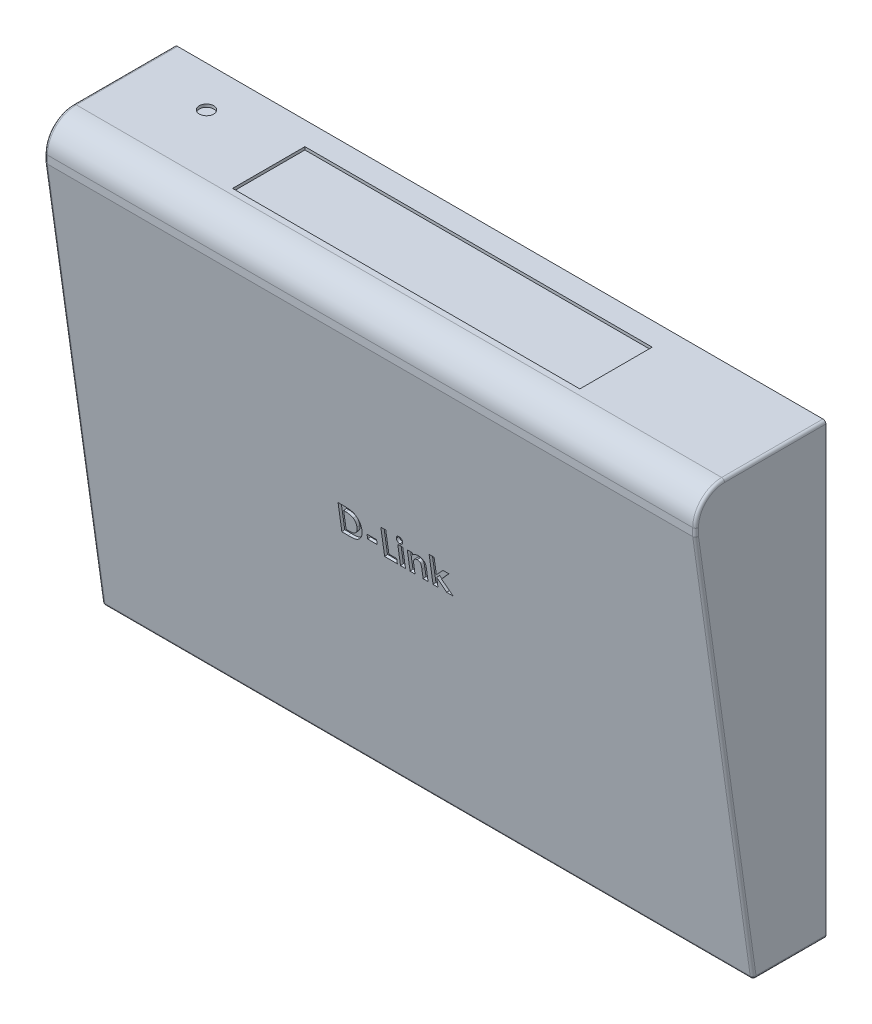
SolidWorks part; units mm, degrees
ref_plane "Front" through (0, 0, 0) normal (0, 0, 1) x (1, 0, 0)
ref_plane "Top" through (0, 0, 0) normal (0, 1, 0) x (1, 0, 0)
ref_plane "Right" through (0, 0, 0) normal (1, 0, 0) x (0, 0, -1)
sketch "Sketch2" plane through (0, 0, 0) normal (0, 0, 1) x (1, 0, 0)
  line L1 (-45.4511, 46.4223) -> (179.5489, 46.4223)
  line L2 (-45.4511, 46.4223) -> (-45.4511, -108.5777)
  line L3 (-45.4511, -108.5777) -> (179.5489, -108.5777)
  line L4 (179.5489, 46.4223) -> (179.5489, -108.5777)
  dimension "D1" = 225
  dimension "D2" = 155
extrude "Boss-Extrude1" add sketch "Sketch2" along normal blind 45
chamfer "Chamfer1" distance 20 angle 82 1 edges at (67.0489, -108.5777, 45)
fillet "Fillet1" radius 10 1 edges at (67.0489, 46.4223, 45)
fillet "Fillet2" radius 1 11 edges at (67.0489, -108.5777, 25) (179.5489, 35.076, 45) (179.5489, 43.4934, 42.0711) (-45.4511, 35.076, 45) (-45.4511, 43.4934, 42.0711) (179.5489, 46.4223, 17.5) (-45.4511, 46.4223, 17.5) (179.5489, -37.424, 35) (179.5489, -108.5777, 12.5) (-45.4511, -108.5777, 12.5) (-45.4511, -37.424, 35)
ref_plane "Plane1" through (0, -5.5485, 39.4798) normal (0, -0.1392, 0.9903) x (1, 0, 0)
sketch "Sketch3" plane through (0, -5.5485, 39.4798) normal (0, -0.1392, 0.9903) x (1, 0, 0)
  text T0 "D-Link" font "Century Gothic" height in points 36
extrude "Cut-Extrude1" cut sketch "Sketch3" against normal blind 1
ref_plane "Plane2" through (0, 46.4223, 0) normal (0, 1, 0) x (1, 0, 0)
sketch "Sketch4" plane through (0, 46.4223, 0) normal (0, 1, 0) x (1, 0, 0)
  line L0 (-44.4511, 0) -> (-44.4511, -35) construction
  line L1 (7.5489, -8) -> (127.5489, -8)
  line L2 (7.5489, -8) -> (7.5489, -33)
  line L3 (7.5489, -33) -> (127.5489, -33)
  line L4 (127.5489, -8) -> (127.5489, -33)
  line L7 (178.5489, 0) -> (-44.4511, 0) construction
  dimension "D1" = 120
  dimension "D2" = 25
  dimension "D3" = 52
  dimension "D4" = 8
extrude "Cut-Extrude2" cut sketch "Sketch4" against normal blind 1
sketch "Sketch5" plane through (0, 46.4223, 0) normal (0, 1, 0) x (1, 0, 0)
  line L0 (-44.4511, 0) -> (-44.4511, -35) construction
  line L1 (178.5489, 0) -> (-44.4511, 0) construction
  circle A0 centre (-20.4511, -14) radius 2.5
  dimension "D1" = 24
  dimension "D3" = 5
  dimension "D2" = 14
extrude "Cut-Extrude3" cut sketch "Sketch5" against normal blind 1
ref_plane "Plane3" through (0, 0, 0) normal (0, 0, -1) x (-1, 0, 0)
sketch "Sketch6" plane through (0, 0, 0) normal (0, 0, -1) x (-1, 0, 0)
  line L0 (-179.5489, -107.5777) -> (-179.5489, 45.4223) construction
  line L2 (44.4511, -108.5777) -> (-178.5489, -108.5777) construction
  circle A0 centre (-157.0489, -31.5777) radius 4
  circle A1 centre (22.9511, -31.5777) radius 4
  dimension "D1" = 180
  dimension "D3" = 8
  dimension "D4" = 8
  dimension "D2" = 22.5
  dimension "D5" = 77
  dimension "D6" = 77
extrude "Cut-Extrude4" cut sketch "Sketch6" against normal blind 5
sketch "Sketch7" plane through (0, 0, 0) normal (0, 0, -1) x (-1, 0, 0)
  line L0 (-179.5489, -107.5777) -> (-179.5489, 45.4223) construction
  line L1 (45.4511, 45.4223) -> (45.4511, -107.5777) construction
  line L2 (-178.5489, 46.4223) -> (44.4511, 46.4223) construction
  line L3 (44.4511, -108.5777) -> (-178.5489, -108.5777) construction
  ellipse E0 centre (-164.5489, 26.4223) end of major axis (-164.5489, 18.4223) minor radius 4
  ellipse E1 centre (-164.5489, -88.5777) end of major axis (-164.5489, -96.5777) minor radius 4
  ellipse E2 centre (30.4511, 26.4223) end of major axis (30.4511, 18.4223) minor radius 4
  ellipse E3 centre (30.4511, -88.5777) end of major axis (30.4511, -96.5777) minor radius 4
  dimension "D1" = 16
  dimension "D2" = 16
  dimension "D3" = 16
  dimension "D4" = 16
  dimension "D5" = 8
  dimension "D6" = 8
  dimension "D7" = 8
  dimension "D8" = 8
  dimension "D9" = 15
  dimension "D10" = 15
  dimension "D11" = 15
  dimension "D12" = 15
  dimension "D13" = 20
  dimension "D14" = 20
  dimension "D15" = 20
  dimension "D16" = 20
extrude "Boss-Extrude2" add sketch "Sketch7" along normal blind 3
